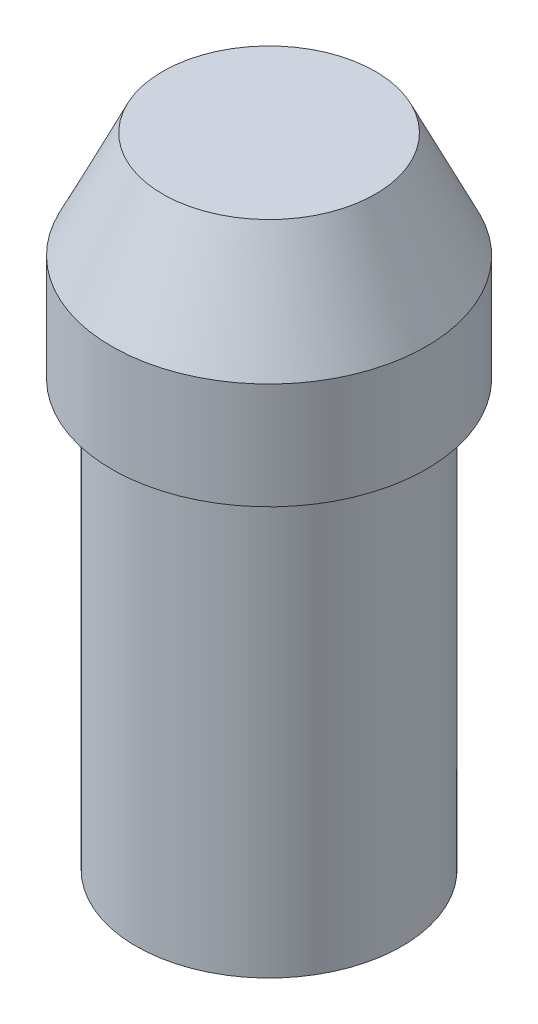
SolidWorks part; units mm, degrees
ref_plane "Front Plane" through (0, 0, 0) normal (0, 0, 1) x (1, 0, 0)
ref_plane "Top Plane" through (0, 0, 0) normal (0, 1, 0) x (1, 0, 0)
ref_plane "Right Plane" through (0, 0, 0) normal (1, 0, 0) x (0, 0, -1)
sketch "Sketch1" plane through (0, 0, 0) normal (0, 0, 1) x (1, 0, 0)
  line L0 (0, 6.35) -> (0, -12.7)
  line L1 (0, 6.35) -> (3.175, 6.35)
  line L3 (4.699, 0) -> (3.9688, 0)
  line L4 (3.9688, 0) -> (3.9688, -12.7)
  line L5 (3.9688, -12.7) -> (0, -12.7)
  line L6 (0, -12.7) -> (0, -61.445) construction
  line L7 (4.699, 0) -> (4.699, 3.175)
  line L8 (4.699, 3.175) -> (3.175, 6.35)
  dimension "D1" = 12.7
  dimension "D2" = 7.9375
  dimension "D3" = 6.35
  dimension "D4" = 9.398
  dimension "D5" = 6.35
  dimension "D6" = 3.175
revolve "Revolve1" add sketch "Sketch1" angle 360 about L6
